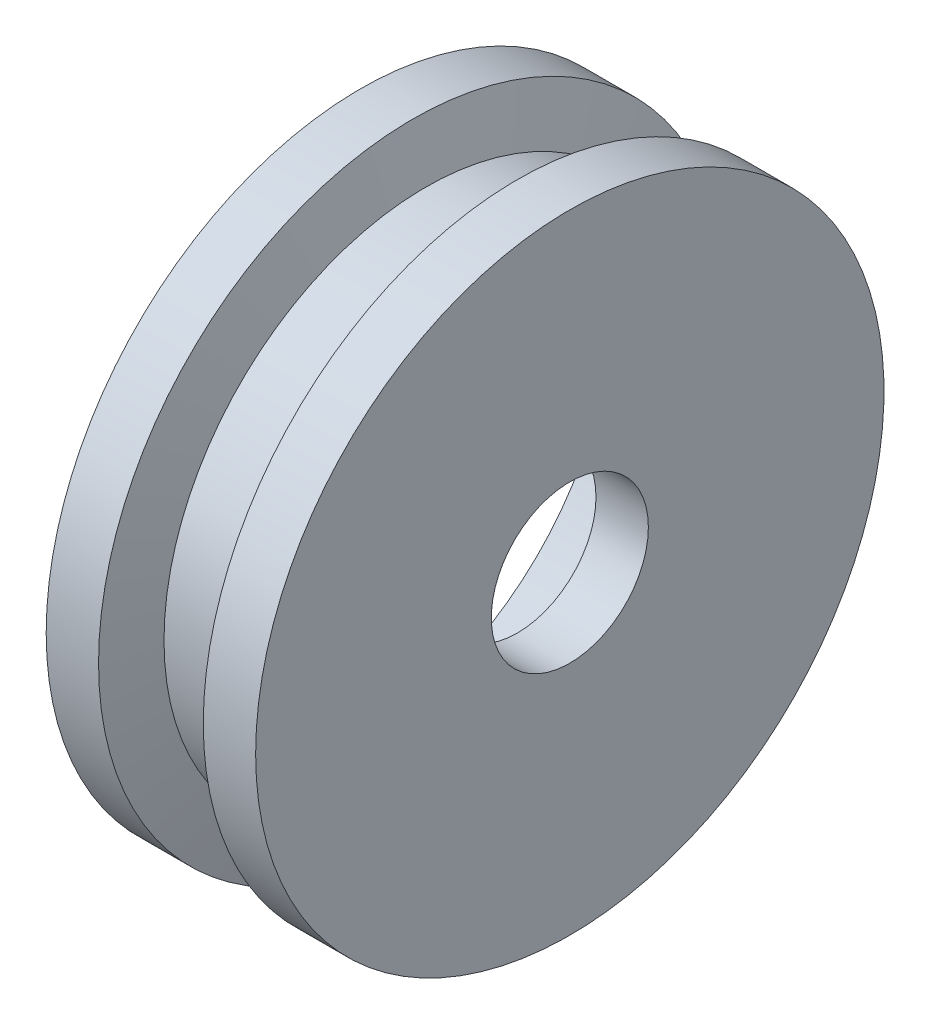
SolidWorks part; units mm, degrees
ref_plane "Plan de face" through (0, 0, 0) normal (0, 0, 1) x (1, 0, 0)
ref_plane "Plan de dessus" through (0, 0, 0) normal (0, 1, 0) x (1, 0, 0)
ref_plane "Plan de droite" through (0, 0, 0) normal (1, 0, 0) x (0, 0, -1)
sketch "Esquisse1" plane through (0, 0, 0) normal (0, 0, 1) x (1, 0, 0)
  line L0 (-12.9633, 0) -> (9.3269, 0) construction
  line L1 (-2, 12) -> (-1.5, 10)
  line L2 (-4, 0) -> (4, 0)
  line L3 (-4, 0) -> (-4, 12)
  line L4 (-4, 12) -> (-2, 12)
  line L5 (4, 0) -> (4, 12)
  line L6 (-1.5, 10) -> (1.5, 10)
  line L7 (1.5, 10) -> (2, 12)
  line L8 (2, 12) -> (4, 12)
  point P10 (0, 19.1667)
  point P12 (0, 0)
  point P13 (0, 0)
  point P14 (0, 0)
  point P15 (0, 10)
  point P16 (-1.5737, 10)
  point P17 (-0.918, 23)
  point P18 (0, 0)
  point P19 (2.9283, 23)
  dimension "D1" = 12
  dimension "D2" = 8
  dimension "D3" = 3
  dimension "D4" = 2
  dimension "D5" = 2
  dimension "D6" = 2
revolve "Révolution1" add sketch "Esquisse1" angle 360 about L0
sketch "Esquisse2" plane through (-4, 0, 0) normal (-1, 0, 0) x (0, 0, 1)
  circle A0 centre (0, 0) radius 9.6
  dimension "D1" = 19.2
extrude "Enlèv. mat.-Extru.1" cut sketch "Esquisse2" against normal blind 6
sketch "Esquisse3" plane through (4, 0, 0) normal (1, 0, 0) x (0, 0, -1)
  circle A0 centre (0, 0) radius 3
  dimension "D1" = 6
extrude "Enlèv. mat.-Extru.2" cut sketch "Esquisse3" against normal blind 8
